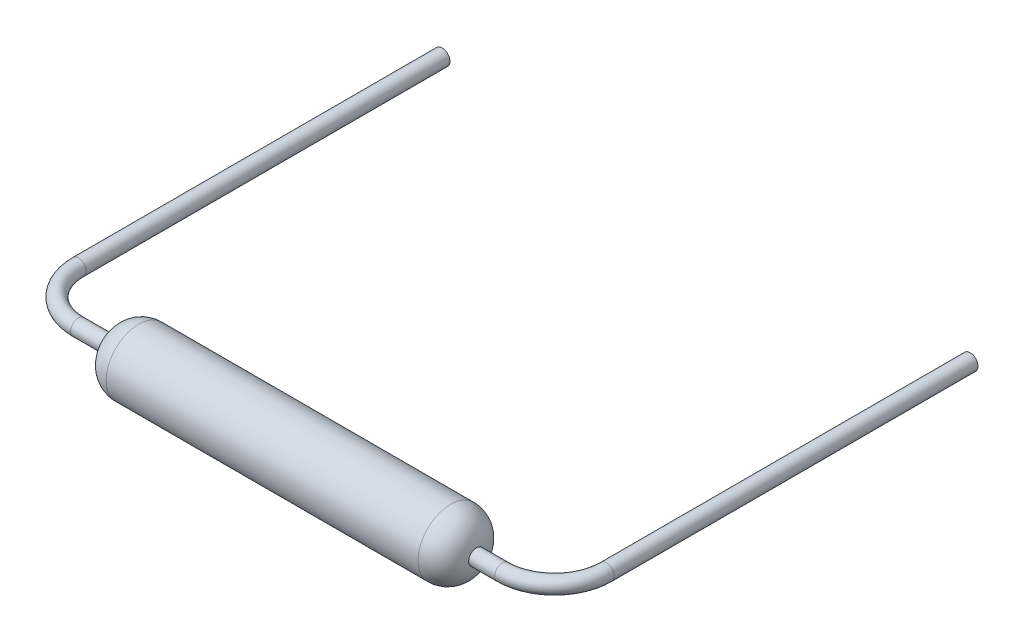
SolidWorks part; units mm, degrees
ref_plane "Plan1" through (0, 0, 0) normal (0, 0, 1) x (1, 0, 0)
ref_plane "Plan2" through (0, 0, 0) normal (0, 1, 0) x (1, 0, 0)
ref_plane "Plan3" through (0, 0, 0) normal (1, 0, 0) x (0, 0, -1)
sketch "Esquisse6" plane through (0, 0, 0) normal (0, 1, 0) x (1, 0, 0)
  line L0 (0, 0) -> (0, -14)
  line L1 (2, -16) -> (3.32, -16)
  arc A0 (2, -16) -> (0, -14) centre (2, -14) cw
  dimension "D1" = 2
  dimension "D2" = 14
  dimension "D3" = 1.32
sketch "Esquisse7" plane through (0, 0, 0) normal (0, 0, 1) x (1, 0, 0)
  circle A0 centre (0, 0) radius 0.3
  dimension "D1" = 0.6
sweep "Base-Balayage" add profiles "Esquisse7" path "Esquisse6"
sketch "Esquisse9" plane through (3.32, 0, 0) normal (1, 0, 0) x (0, 0, -1)
  circle A0 centre (-16, 0) radius 1.25
extrude "Boss.-Extru.2" add sketch "Esquisse9" along normal blind 14
sketch "Esquisse11" plane through (17.32, 0, 0) normal (1, 0, 0) x (0, 0, -1)
  circle A0 centre (-16, 0) radius 0.3
  dimension "D1" = 0.6
sketch "Esquisse12" plane through (0, 0, 0) normal (0, 1, 0) x (1, 0, 0)
  line L0 (17.32, -16) -> (18.32, -16)
  line L1 (20.32, -14) -> (20.32, 0)
  arc A0 (20.32, -14) -> (18.32, -16) centre (18.32, -14) cw
  dimension "D1" = 2
  dimension "D2" = 1
sweep "Boss.-Balayage1" add profiles "Esquisse11" path "Esquisse12"
fillet "Congé1" radius 1
